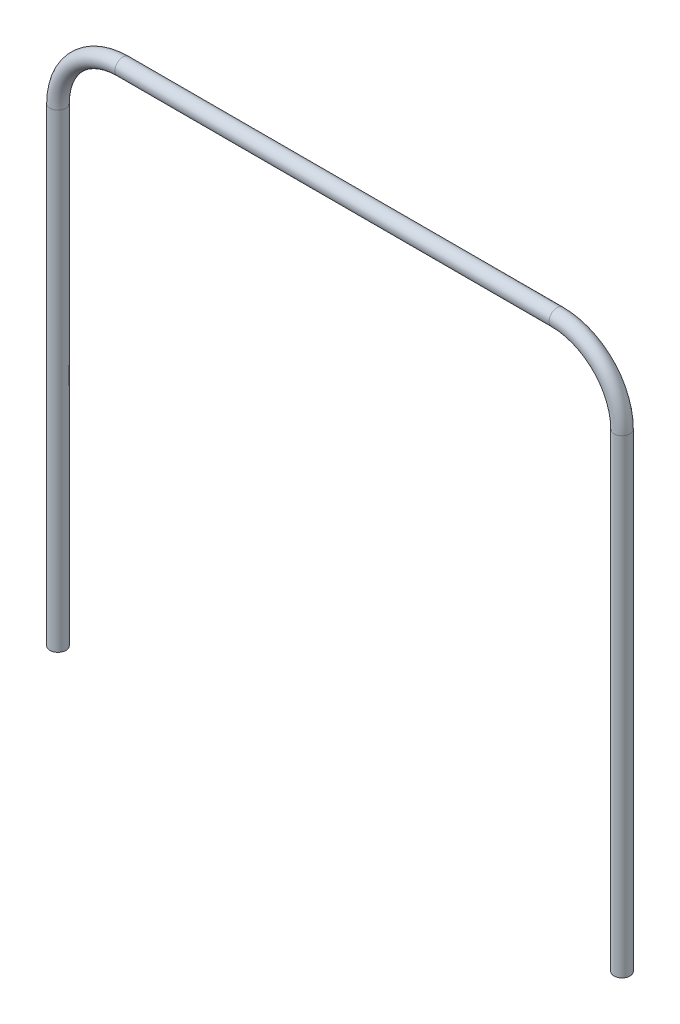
SolidWorks part; units mm, degrees
ref_plane "Plan1" through (0, 0, 0) normal (0, 0, 1) x (1, 0, 0)
ref_plane "Plan2" through (0, 0, 0) normal (0, 1, 0) x (1, 0, 0)
ref_plane "Plan3" through (0, 0, 0) normal (1, 0, 0) x (0, 0, -1)
sketch "Esquisse1" plane through (0, 0, 0) normal (0, 0, 1) x (1, 0, 0)
  line L0 (0, 0) -> (0, 470)
  line L1 (65, 535) -> (499.55, 535)
  line L2 (564.55, 470) -> (564.55, 0)
  arc A0 (499.55, 535) -> (564.55, 470) centre (499.55, 470) cw
  arc A1 (0, 470) -> (65, 535) centre (65, 470) cw
  point P7 (564.55, 535)
  point P10 (0, 535)
  dimension "D3" = 65
  dimension "D4" = 65
  dimension "D1" = 564.55
  dimension "D2" = 535
sketch "Esquisse2" plane through (0, 0, 0) normal (0, 1, 0) x (1, 0, 0)
  circle A0 centre (0, 0) radius 8
  circle A1 centre (0, 0) radius 7
  dimension "D1" = 16
  dimension "D2" = 14
sweep "Base-Balayage" add profiles "Esquisse2" path "Esquisse1"
